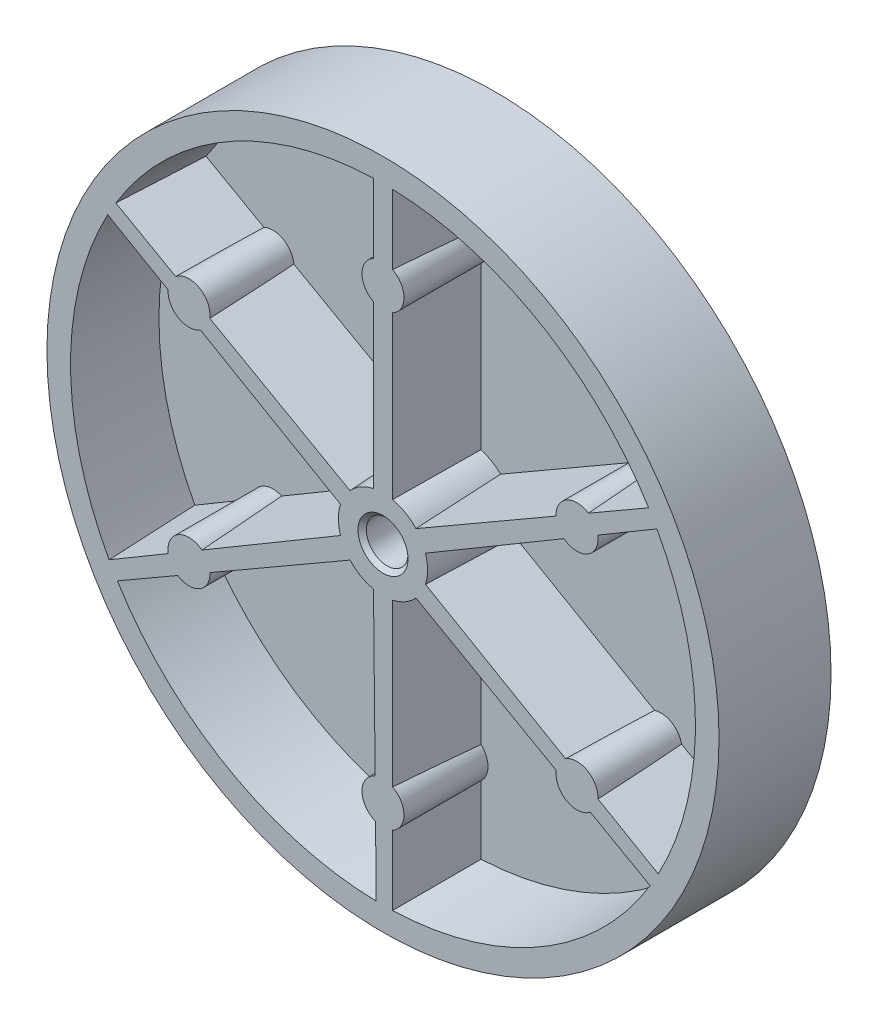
SolidWorks part; units mm, degrees
ref_plane "Face" through (0, 0, 0) normal (0, 0, 1) x (1, 0, 0)
ref_plane "Dessus" through (0, 0, 0) normal (0, 1, 0) x (1, 0, 0)
ref_plane "Droite" through (0, 0, 0) normal (1, 0, 0) x (0, 0, -1)
sketch "Esquisse1" plane through (0, 0, 0) normal (0, 0, 1) x (1, 0, 0)
  circle A0 centre (0, 0) radius 24
extrude "Base-Extrusion" add sketch "Esquisse1" along normal blind 8
sketch "Esquisse2" plane through (0, 0, 8) normal (0, 0, 1) x (1, 0, 0)
  circle A0 centre (0, 0) radius 22
  circle A1 centre (0, 0) radius 3.5
extrude "Enlèv. mat.-Extru.1" cut sketch "Esquisse2" against normal blind 6
sketch "Esquisse3" plane through (0, 0, 8) normal (0, 0, 1) x (1, 0, 0)
  circle A0 centre (0, 0) radius 1.485
extrude "Enlèv. mat.-Extru.2" cut sketch "Esquisse3" against normal through all
sketch "Esquisse4" plane through (0, 0, 0) normal (0, 0, 1) x (1, 0, 0)
  line L0 (0, 19.2625) -> (0, -20.4047) construction
  line L1 (-1, 18.7433) -> (-1, 2.3364) construction
  line L2 (1, 18.7433) -> (1, 2.3364) construction
  line L3 (18.9246, 12.0808) -> (19.8227, 10.5254)
  line L4 (-1, 22.4296) -> (-1, 2.3364)
  line L5 (-1, 2.3364) -> (1, 2.3364)
  line L7 (-1, 22.4296) -> (0.7961, 22.4296)
  line L8 (18.9246, 12.0808) -> (1.5234, 2.0342)
  line L9 (1.5234, 2.0342) -> (2.5234, 0.3022)
  line L10 (19.8227, 10.5254) -> (2.5234, 0.3022)
  line L11 (19.9246, -10.3488) -> (19.0266, -11.9043)
  line L12 (19.9246, -10.3488) -> (2.5234, -0.3022)
  line L13 (2.5234, -0.3022) -> (1.5234, -2.0342)
  line L14 (19.0266, -11.9043) -> (1.5234, -2.0342)
  line L15 (1, -22.4296) -> (-0.7961, -22.4296)
  line L16 (1, -22.4296) -> (1, -2.3364)
  line L17 (1, -2.3364) -> (-1, -2.3364)
  line L18 (-0.7961, -22.4296) -> (-1, -2.3364)
  line L19 (-18.9246, -12.0808) -> (-19.8227, -10.5254)
  line L20 (-18.9246, -12.0808) -> (-1.5234, -2.0342)
  line L21 (-1.5234, -2.0342) -> (-2.5234, -0.3022)
  line L22 (-19.8227, -10.5254) -> (-2.5234, -0.3022)
  line L23 (-19.9246, 10.3488) -> (-19.0266, 11.9043)
  line L24 (-19.9246, 10.3488) -> (-2.5234, 0.3022)
  line L25 (-2.5234, 0.3022) -> (-1.5234, 2.0342)
  line L26 (-19.0266, 11.9043) -> (-1.5234, 2.0342)
  line L27 (0.7961, 22.4296) -> (1, 2.3364)
  line L28 (-1, 2.8134) -> (1, 2.8134)
  line L29 (-1, 2.8134) -> (-1, 22.7283)
  line L30 (-1, 22.7283) -> (1, 22.7283)
  line L31 (1, 2.8134) -> (1, 22.7283)
extrude "Boss.-Extru.1" add sketch "Esquisse4" along normal blind 8
draft "Dépouille1" type of draft neutral plane draft angle 3 faces to draft 1 parameters "D1"=3
draft "Dépouille2" type of draft neutral plane draft angle 3 faces to draft 1 parameters "D1"=3
draft "Dépouille3" type of draft neutral plane draft angle 3 faces to draft 1 parameters "D1"=3
draft "Dépouille4" type of draft neutral plane draft angle 3 faces to draft 1 parameters "D1"=3
draft "Dépouille5" type of draft neutral plane draft angle 3 faces to draft 1 parameters "D1"=3
draft "Dépouille6" type of draft neutral plane draft angle 3 faces to draft 1 parameters "D1"=3
sketch "Esquisse5" plane through (0, 0, 0) normal (0, 0, 1) x (1, 0, 0)
  line L0 (0, 18.5356) -> (0, 6.542) construction
  line L1 (-2.7258, 16) -> (7.6583, 16) construction
  circle A0 centre (0, 16) radius 1.5
  circle A1 centre (13.8564, 8) radius 1.5
  circle A2 centre (13.8564, -8) radius 1.5
  circle A3 centre (0, -16) radius 1.5
  circle A4 centre (-13.8564, -8) radius 1.5
  circle A5 centre (-13.8564, 8) radius 1.5
extrude "Boss.-Extru.2" add sketch "Esquisse5" along normal blind 8
chamfer "Chanfrein1" distance 0.3 angle 45
